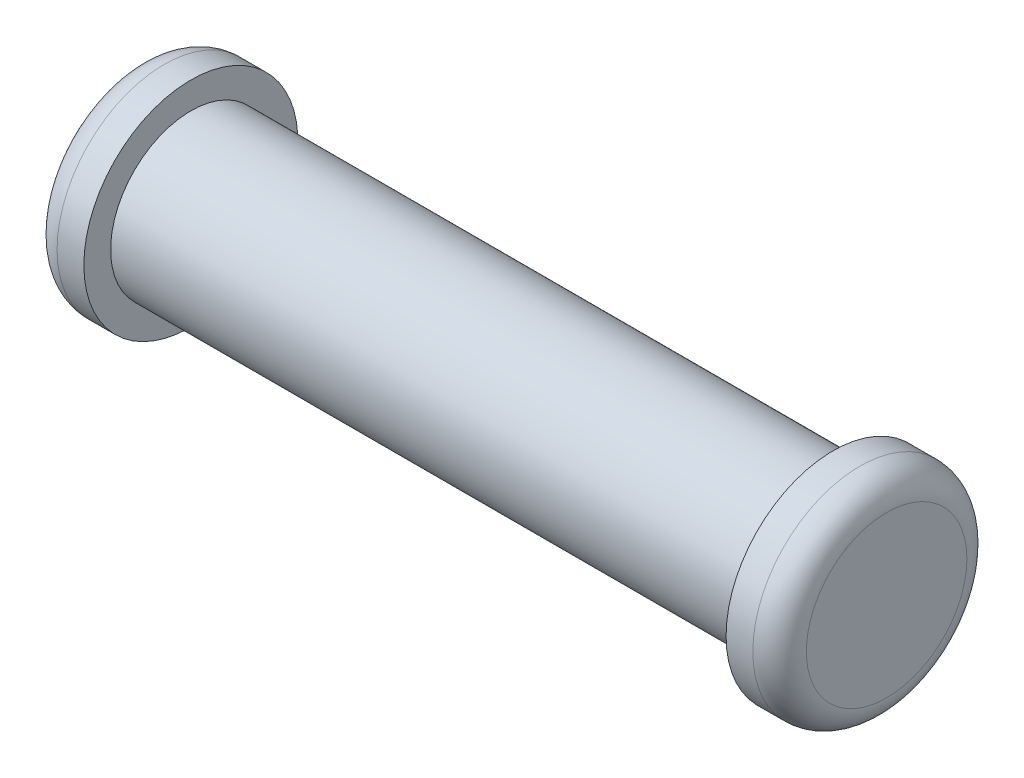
SolidWorks part; units mm, degrees
ref_plane "Front Plane" through (0, 0, 0) normal (0, 0, 1) x (1, 0, 0)
ref_plane "Top Plane" through (0, 0, 0) normal (0, 1, 0) x (1, 0, 0)
ref_plane "Right Plane" through (0, 0, 0) normal (1, 0, 0) x (0, 0, -1)
sketch "Sketch1" plane through (0, 0, 0) normal (1, 0, 0) x (0, 0, -1)
  circle A0 centre (0, 0) radius 1.5
  dimension "D1" = 3
extrude "Boss-Extrude1" add sketch "Sketch1" along normal blind 12
sketch "Sketch2" plane through (0, 0, 0) normal (-1, 0, 0) x (0, 0, 1)
  circle A0 centre (0, 0) radius 2
  dimension "D1" = 4
extrude "Boss-Extrude2" add sketch "Sketch2" along normal blind 1
fillet "Fillet2" radius 0.5 1 edges at (-1, 0, 2)
ref_plane "Plane1" through (6, 0, 0) normal (1, 0, 0) x (0, 0, -1)
mirror "Mirror1" about plane through (6, 0, 0) normal (1, 0, 0) of "Fillet2", "Boss-Extrude2"
